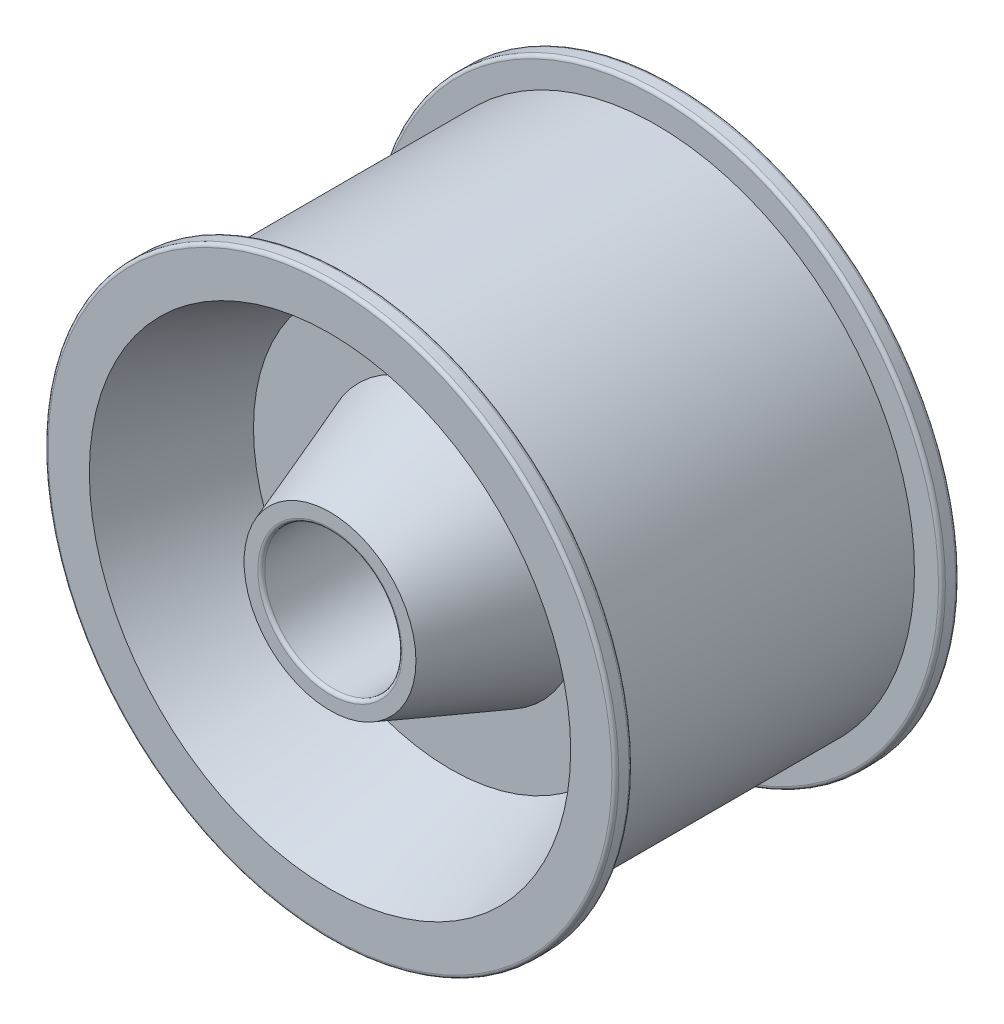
SolidWorks part; units mm, degrees
ref_plane "Ebene vorne" through (0, 0, 0) normal (0, 0, 1) x (1, 0, 0)
ref_plane "Ebene oben" through (0, 0, 0) normal (0, 1, 0) x (1, 0, 0)
ref_plane "Ebene rechts" through (0, 0, 0) normal (1, 0, 0) x (0, 0, -1)
sketch "Skizze1" plane through (0, 0, 0) normal (1, 0, 0) x (0, 0, -1)
  line L0 (-69.0104, 0) -> (86.7187, 0) construction
  line L1 (0, 76.9531) -> (0, -60.2865) construction
  line L2 (49, 20) -> (-49, 20)
  line L3 (-50, 21) -> (-50, 25)
  line L4 (-50, 25) -> (-15, 37.739)
  line L5 (-15, 37.739) -> (-15, 57.261)
  line L6 (-15, 57.261) -> (-50, 70)
  line L7 (-50, 70) -> (-50, 82)
  line L8 (-49, 83) -> (-46, 83)
  line L9 (-45, 82) -> (-45, 75)
  line L10 (-45, 75) -> (45, 75)
  line L11 (50, 21) -> (50, 25)
  line L12 (50, 25) -> (15, 37.739)
  line L13 (15, 37.739) -> (15, 57.261)
  line L14 (15, 57.261) -> (50, 70)
  line L15 (50, 70) -> (50, 82)
  line L16 (49, 83) -> (46, 83)
  line L17 (45, 82) -> (45, 75)
  arc A0 (-49, 20) -> (-50, 21) centre (-49, 21) cw
  arc A1 (50, 21) -> (49, 20) centre (49, 21) cw
  arc A2 (50, 82) -> (49, 83) centre (49, 82) ccw
  arc A3 (46, 83) -> (45, 82) centre (46, 82) ccw
  arc A4 (-46, 83) -> (-45, 82) centre (-46, 82) cw
  arc A5 (-50, 82) -> (-49, 83) centre (-49, 82) cw
  point P7 (-50, 23)
  point P17 (0, 20)
  point P24 (0, 75)
  point P25 (50, 23)
  point P28 (-50, 20)
  point P31 (50, 20)
  point P34 (50, 83)
  point P37 (45, 83)
  point P40 (-45, 83)
  point P43 (-50, 83)
  dimension "D4" = 1
  dimension "D1" = 100
  dimension "D2" = 90
  dimension "D3" = 30
  dimension "D5" = 40
  dimension "D6" = 5
  dimension "D7" = 45
  dimension "D8" = 20
  dimension "D9" = 8
  dimension "D10" = 150
  dimension "D11" = 100
  dimension "D12" = 20
revolve "Rotation1" add sketch "Skizze1" angle 360 about L0
